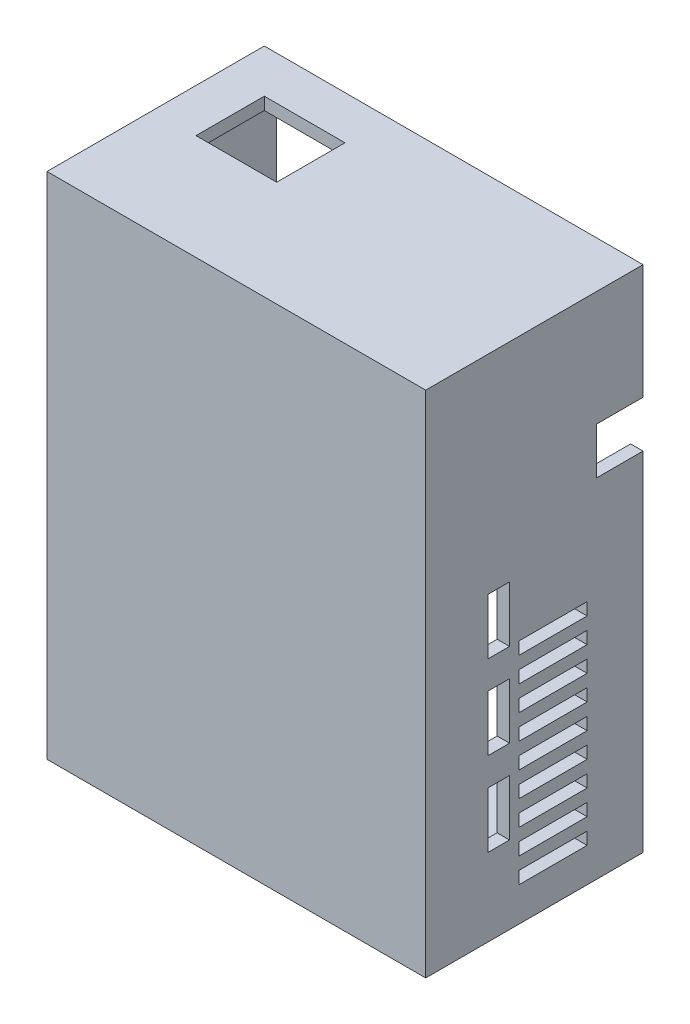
SolidWorks part; units mm, degrees
ref_plane "Alzado" through (0, 0, 0) normal (0, 0, 1) x (1, 0, 0)
ref_plane "Planta" through (0, 0, 0) normal (0, 1, 0) x (1, 0, 0)
ref_plane "Vista lateral" through (0, 0, 0) normal (1, 0, 0) x (0, 0, -1)
sketch "Croquis1" plane through (0, 0, 0) normal (0, 0, 1) x (1, 0, 0)
  line L1 (-64.8461, 56.6347) -> (-3.8461, 56.6347)
  line L2 (-64.8461, 56.6347) -> (-64.8461, -25.3653)
  line L3 (-64.8461, -25.3653) -> (-3.8461, -25.3653)
  line L4 (-3.8461, 56.6347) -> (-3.8461, -25.3653)
  line L5 (-64.8461, 56.6347) -> (-3.8461, -25.3653) construction
  line L6 (-64.8461, -25.3653) -> (-3.8461, 56.6347) construction
  point P0 (-34.3461, 15.6347)
  dimension "D1" = 82
  dimension "D2" = 61
extrude "Saliente-Extruir1" add sketch "Croquis1" along normal blind 35
sketch "Croquis2" plane through (0, 0, 0) normal (0, 0, -1) x (-1, 0, 0)
  line L0 (3.8461, -25.3653) -> (3.8461, 56.6347) construction
  line L1 (5.8461, 54.6347) -> (62.8461, 54.6347)
  line L2 (5.8461, 54.6347) -> (5.8461, -23.3653)
  line L3 (5.8461, -23.3653) -> (62.8461, -23.3653)
  line L4 (62.8461, 54.6347) -> (62.8461, -23.3653)
  line L5 (5.8461, 54.6347) -> (62.8461, -23.3653) construction
  line L6 (5.8461, -23.3653) -> (62.8461, 54.6347) construction
  line L7 (3.8461, 56.6347) -> (64.8461, 56.6347) construction
  point P0 (34.3461, 15.6347)
  dimension "D1" = 78
  dimension "D2" = 57
  dimension "D3" = 2
  dimension "D4" = 2
extrude "Cortar-Extruir1" cut sketch "Croquis2" against normal blind 33
sketch "Croquis3" plane through (0, 0, 0) normal (0, 0, -1) x (-1, 0, 0)
  line L0 (3.8461, 56.6347) -> (64.8461, 56.6347) construction
  line L1 (64.8461, 56.6347) -> (60.8461, 56.6347)
  line L2 (64.8461, 56.6347) -> (64.8461, 52.6347)
  line L3 (64.8461, 52.6347) -> (60.8461, 52.6347)
  line L4 (60.8461, 56.6347) -> (60.8461, 52.6347)
  line L5 (64.8461, 56.6347) -> (60.8461, 52.6347) construction
  line L6 (64.8461, 52.6347) -> (60.8461, 56.6347) construction
  line L7 (64.8461, 56.6347) -> (64.8461, -25.3653) construction
  line L8 (3.8461, -25.3653) -> (3.8461, 56.6347) construction
  line L9 (3.8461, 52.6347) -> (7.8461, 52.6347)
  line L10 (3.8461, 52.6347) -> (3.8461, 56.6347)
  line L11 (3.8461, 56.6347) -> (7.8461, 56.6347)
  line L12 (7.8461, 52.6347) -> (7.8461, 56.6347)
  line L13 (3.8461, 52.6347) -> (7.8461, 56.6347) construction
  line L14 (3.8461, 56.6347) -> (7.8461, 52.6347) construction
  line L15 (64.8461, -25.3653) -> (3.8461, -25.3653) construction
  line L16 (3.8461, -25.3653) -> (7.8461, -25.3653)
  line L17 (3.8461, -25.3653) -> (3.8461, -21.3653)
  line L18 (3.8461, -21.3653) -> (7.8461, -21.3653)
  line L19 (7.8461, -25.3653) -> (7.8461, -21.3653)
  line L20 (3.8461, -25.3653) -> (7.8461, -21.3653) construction
  line L21 (3.8461, -21.3653) -> (7.8461, -25.3653) construction
  line L22 (64.8461, -25.3653) -> (60.8461, -25.3653)
  line L23 (64.8461, -25.3653) -> (64.8461, -21.3653)
  line L24 (64.8461, -21.3653) -> (60.8461, -21.3653)
  line L25 (60.8461, -25.3653) -> (60.8461, -21.3653)
  line L26 (64.8461, -25.3653) -> (60.8461, -21.3653) construction
  line L27 (64.8461, -21.3653) -> (60.8461, -25.3653) construction
  point P0 (62.8461, 54.6347)
  point P9 (5.8461, 54.6347)
  point P16 (5.8461, -23.3653)
  point P21 (62.8461, -23.3653)
  dimension "D1" = 4
  dimension "D2" = 4
  dimension "D3" = 0
  dimension "D4" = 0
  dimension "D5" = 4
  dimension "D6" = 4
  dimension "D7" = 0
  dimension "D8" = 0
  dimension "D9" = 4
  dimension "D10" = 4
  dimension "D11" = 0
  dimension "D12" = 0
  dimension "D13" = 4
  dimension "D14" = 4
  dimension "D15" = 0
  dimension "D16" = 0
extrude "Saliente-Extruir2" add sketch "Croquis3" against normal blind 10
sketch "Croquis4" plane through (0, 0, 33) normal (0, 0, -1) x (-1, 0, 0)
  line L0 (56.8461, -5.3653) -> (56.8461, 44.6347) construction
  line L1 (62.8461, -23.3653) -> (62.8461, 54.6347) construction
  line L2 (5.8461, 54.6347) -> (62.8461, 54.6347) construction
  line L3 (9.3461, 42.1347) -> (59.3461, 42.1347) construction
  line L4 (5.8461, 54.6347) -> (5.8461, -23.3653) construction
  line L5 (59.3461, -5.3653) -> (9.3461, -5.3653) construction
  line L6 (59.3461, -5.3653) -> (59.3461, 44.6347) construction
  line L7 (59.3461, 44.6347) -> (9.3461, 44.6347) construction
  line L8 (9.3461, -5.3653) -> (9.3461, 44.6347) construction
  line L9 (11.8461, -5.3653) -> (11.8461, 44.6347) construction
  line L10 (59.3461, -2.8653) -> (9.3461, -2.8653) construction
  circle A0 centre (56.8461, -2.3653) radius 1.5
  circle A1 centre (11.8461, -2.8653) radius 1.5
  circle A2 centre (56.8461, 42.1347) radius 1.5
  circle A3 centre (11.8461, 42.1347) radius 1.5
  point P21 (56.8461, -2.3653)
  point P22 (11.8461, -2.8653)
  point P23 (11.8461, 42.1347)
  point P24 (56.8461, 42.1347)
  dimension "D1" = 50
  dimension "D2" = 50
  dimension "D3" = 3.5
  dimension "D4" = 50
  dimension "D5" = 3.5
  dimension "D6" = 10
  dimension "D7" = 2.5
  dimension "D8" = 2.5
  dimension "D9" = 2.5
  dimension "D10" = 2.5
extrude "Cortar-Extruir2" cut sketch "Croquis4" against normal blind 1.5
sketch "Croquis5" plane through (0, 0, 33) normal (0, 0, -1) x (-1, 0, 0)
  line L0 (5.8461, 51.1347) -> (61.6498, 51.1347) construction
  line L2 (62.8461, 54.6347) -> (5.8461, 54.6347) construction
  line L3 (62.8461, 33.1347) -> (-9.2086, 33.1347) construction
  line L4 (11.8461, 32.1347) -> (15.8461, 32.1347)
  line L5 (62.8461, 30.1347) -> (5.8461, 30.1347) construction
  line L6 (62.8461, -23.3653) -> (62.8461, 54.6347) construction
  line L7 (5.8461, 54.6347) -> (5.8461, -23.3653) construction
  line L8 (5.8461, 33.1347) -> (62.8461, 51.1347) construction
  line L9 (59.3461, 30.1347) -> (9.3461, 30.1347) construction
  line L10 (59.3461, 30.1347) -> (59.3461, -19.8653) construction
  line L11 (59.3461, -19.8653) -> (9.3461, -19.8653) construction
  line L12 (9.3461, 30.1347) -> (9.3461, -19.8653) construction
  line L13 (56.8461, -17.3653) -> (11.8461, -17.3653) construction
  line L14 (56.8461, -17.3653) -> (56.8461, 27.6347) construction
  line L15 (56.8461, 27.6347) -> (11.8461, 27.6347) construction
  line L16 (11.8461, -17.3653) -> (11.8461, 27.6347) construction
  line L17 (59.3461, -19.8653) -> (54.3461, -19.8653)
  line L18 (59.3461, -19.8653) -> (59.3461, -14.8653)
  line L19 (59.3461, -14.8653) -> (54.3461, -14.8653)
  line L20 (54.3461, -19.8653) -> (54.3461, -14.8653)
  line L21 (59.3461, -19.8653) -> (54.3461, -14.8653) construction
  line L22 (59.3461, -14.8653) -> (54.3461, -19.8653) construction
  line L23 (9.3461, -19.8653) -> (14.3461, -19.8653)
  line L24 (9.3461, -19.8653) -> (9.3461, -14.8653)
  line L25 (9.3461, -14.8653) -> (14.3461, -14.8653)
  line L26 (14.3461, -19.8653) -> (14.3461, -14.8653)
  line L27 (9.3461, -19.8653) -> (14.3461, -14.8653) construction
  line L28 (9.3461, -14.8653) -> (14.3461, -19.8653) construction
  line L29 (9.3461, 30.1347) -> (14.3461, 30.1347)
  line L30 (9.3461, 30.1347) -> (9.3461, 25.1347)
  line L31 (9.3461, 25.1347) -> (14.3461, 25.1347)
  line L32 (14.3461, 30.1347) -> (14.3461, 25.1347)
  line L33 (9.3461, 30.1347) -> (14.3461, 25.1347) construction
  line L34 (9.3461, 25.1347) -> (14.3461, 30.1347) construction
  line L35 (59.3461, 30.1347) -> (54.3461, 30.1347)
  line L36 (59.3461, 30.1347) -> (59.3461, 25.1347)
  line L37 (59.3461, 25.1347) -> (54.3461, 25.1347)
  line L38 (54.3461, 30.1347) -> (54.3461, 25.1347)
  line L39 (59.3461, 30.1347) -> (54.3461, 25.1347) construction
  line L40 (59.3461, 25.1347) -> (54.3461, 30.1347) construction
  line L41 (62.8461, 51.1347) -> (62.8461, 33.1347) construction
  line L42 (62.8461, 33.1347) -> (5.8461, 51.1347) construction
  line L43 (34.3461, 42.1347) -> (34.3461, 33.1347) construction
  line L44 (34.3461, 33.1347) -> (34.3461, 51.1347) construction
  line L45 (12.8461, 33.1347) -> (12.8461, 51.1347) construction
  line L46 (55.8461, 51.1347) -> (55.8461, 33.1347) construction
  line L47 (11.8461, 32.1347) -> (11.8461, 36.1347)
  line L48 (11.8461, 36.1347) -> (15.8461, 36.1347)
  line L49 (15.8461, 32.1347) -> (15.8461, 36.1347)
  line L50 (11.8461, 48.1347) -> (15.8461, 48.1347)
  line L51 (11.8461, 48.1347) -> (11.8461, 52.1347)
  line L52 (11.8461, 52.1347) -> (15.8461, 52.1347)
  line L53 (15.8461, 48.1347) -> (15.8461, 52.1347)
  line L54 (52.8461, 48.1347) -> (56.8461, 48.1347)
  line L55 (52.8461, 48.1347) -> (52.8461, 52.1347)
  line L56 (52.8461, 52.1347) -> (56.8461, 52.1347)
  line L57 (56.8461, 48.1347) -> (56.8461, 52.1347)
  line L58 (52.8461, 36.1347) -> (56.8461, 36.1347)
  line L59 (52.8461, 36.1347) -> (52.8461, 32.1347)
  line L60 (52.8461, 32.1347) -> (56.8461, 32.1347)
  line L61 (56.8461, 36.1347) -> (56.8461, 32.1347)
  line L62 (14.3461, 49.6347) -> (54.3461, 49.6347) construction
  line L63 (14.3461, 49.6347) -> (14.3461, 34.6347) construction
  line L64 (14.3461, 34.6347) -> (54.3461, 34.6347) construction
  line L65 (54.3461, 49.6347) -> (54.3461, 34.6347) construction
  circle A0 centre (56.8461, -17.3653) radius 1
  circle A1 centre (11.8461, -17.3653) radius 1
  circle A2 centre (56.8461, 27.6347) radius 1
  circle A3 centre (11.8461, 27.6347) radius 1
  circle A4 centre (54.3461, 49.6347) radius 0.6
  circle A5 centre (54.3461, 34.6347) radius 0.6
  circle A6 centre (14.3461, 49.6347) radius 0.6
  circle A7 centre (14.3461, 34.6347) radius 0.6
  point P40 (34.3461, 42.1347)
  point P64 (14.3461, 34.6347)
  point P65 (14.3461, 49.6347)
  dimension "D41" = 2
  dimension "D42" = 2
  dimension "D43" = 2
  dimension "D44" = 2
  dimension "D50" = 1.2
  dimension "D51" = 1.2
  dimension "D52" = 1.2
  dimension "D53" = 1.2
  dimension "D1" = 3.5
  dimension "D2" = 18
  dimension "D3" = 3
  dimension "D4" = 50
  dimension "D5" = 50
  dimension "D6" = 3.5
  dimension "D7" = 3.5
  dimension "D8" = 2.5
  dimension "D9" = 2.5
  dimension "D10" = 2.5
  dimension "D11" = 2.5
  dimension "D12" = 5
  dimension "D13" = 5
  dimension "D14" = 5
  dimension "D15" = 5
  dimension "D16" = 5
  dimension "D17" = 5
  dimension "D18" = 5
  dimension "D19" = 5
  dimension "D20" = 21.5
  dimension "D21" = 21.5
  dimension "D22" = 1
  dimension "D23" = 1
  dimension "D24" = 4
  dimension "D25" = 4
  dimension "D26" = 1
  dimension "D27" = 1
  dimension "D28" = 4
  dimension "D29" = 4
  dimension "D30" = 1
  dimension "D31" = 1
  dimension "D32" = 4
  dimension "D33" = 4
  dimension "D34" = 1
  dimension "D35" = 1
  dimension "D36" = 4
  dimension "D37" = 4
  dimension "D38" = 1.5
  dimension "D39" = 15
  dimension "D40" = 1.5
  dimension "D45" = 1.5
  dimension "D46" = 1.5
  dimension "D47" = 1.5
  dimension "D48" = 15
  dimension "D49" = 1.5
extrude "Saliente-Extruir3" add sketch "Croquis5" along normal blind 4
sketch "Croquis7" plane through (0, 0, 0) normal (0, 0, -1) x (-1, 0, 0)
  line L0 (7.8461, -21.3653) -> (3.8461, -25.3653) construction
  line L1 (3.8461, -25.3653) -> (7.8461, -25.3653) construction
  line L2 (64.8461, -25.3653) -> (3.8461, -25.3653) construction
  line L3 (7.8461, -25.3653) -> (7.8461, -21.3653) construction
  line L4 (7.8461, -21.3653) -> (3.8461, -21.3653) construction
  line L5 (3.8461, -25.3653) -> (3.8461, 56.6347) construction
  line L6 (3.8461, -21.3653) -> (7.8461, -25.3653) construction
  line L8 (7.8461, 52.6347) -> (5.3461, 52.6347) construction
  line L9 (5.8461, 52.6347) -> (7.8461, 52.6347) construction
  line L10 (5.3461, 52.6347) -> (5.3461, 55.1347) construction
  line L11 (5.3461, 55.1347) -> (7.8461, 55.1347) construction
  line L12 (7.8461, 52.6347) -> (7.8461, 54.6347) construction
  line L13 (7.8461, 55.1347) -> (5.3461, 52.6347) construction
  line L14 (5.3461, 52.6347) -> (7.8461, 52.6347) construction
  line L15 (7.8461, 52.6347) -> (5.3461, 55.1347) construction
  circle A0 centre (5.8461, -23.3653) radius 1
  point P10 (5.8461, -23.3653)
  dimension "D1" = 2
extrude "Cortar-Extruir3" cut sketch "Croquis7" against normal blind 6
sketch "Croquis9" plane through (0, 0, 33) normal (0, 0, -1) x (-1, 0, 0)
  line L0 (3.8461, -15.3653) -> (68.4902, -15.3653) construction
  line L1 (3.8461, -25.3653) -> (3.8461, 56.6347) construction
  line L2 (7.8461, -23.3653) -> (60.8461, -23.3653) construction
  line L3 (5.8461, 9.6347) -> (62.8461, 9.6347) construction
  line L4 (5.8461, 52.6347) -> (5.8461, -21.3653) construction
  line L5 (62.8461, -21.3653) -> (62.8461, 52.6347) construction
  line L6 (5.8461, 20.1347) -> (78.2307, 20.1347) construction
  line L7 (54.3461, 25.1347) -> (59.3461, 25.1347) construction
  dimension "D1" = 8
  dimension "D2" = 25
  dimension "D3" = 5
sketch "Croquis10" plane through (0, 0, 0) normal (0, 0, -1) x (-1, 0, 0)
  line L0 (64.8461, -25.3653) -> (60.8461, -21.3653) construction
  line L1 (60.8461, -21.3653) -> (64.8461, -21.3653) construction
  line L2 (64.8461, 56.6347) -> (64.8461, -25.3653) construction
  line L3 (64.8461, -21.3653) -> (60.8461, -25.3653) construction
  line L4 (64.8461, -25.3653) -> (3.8461, -25.3653) construction
  line L5 (60.8461, 52.6347) -> (64.8461, 56.6347) construction
  line L6 (64.8461, 56.6347) -> (64.8461, 52.6347) construction
  line L7 (64.8461, 52.6347) -> (60.8461, 56.6347) construction
  line L8 (3.8461, 56.6347) -> (64.8461, 56.6347) construction
  line L9 (7.8461, 52.6347) -> (3.8461, 56.6347) construction
  line L10 (3.8461, -25.3653) -> (3.8461, 56.6347) construction
  line L11 (3.8461, 56.6347) -> (7.8461, 56.6347) construction
  line L12 (7.8461, 56.6347) -> (3.8461, 52.6347) construction
  circle A0 centre (62.8461, -23.3653) radius 1
  circle A1 centre (5.8461, 54.6347) radius 1
  circle A2 centre (62.8461, 54.6347) radius 1
  point P7 (62.8461, -23.3653)
  point P17 (62.8461, 54.6347)
  point P29 (5.8461, 54.6347)
  dimension "D1" = 2
  dimension "D2" = 2
  dimension "D3" = 2
extrude "Cortar-Extruir4" cut sketch "Croquis10" against normal blind 6
sketch "Croquis11" plane through (-64.8461, 0, 0) normal (-1, 0, 0) x (0, 0, 1)
  line L0 (0, -15.3653) -> (34.0915, -15.3653) construction
  line L1 (0, 56.6347) -> (0, -25.3653) construction
  line L2 (35, -25.3653) -> (0, -25.3653) construction
  line L3 (0, 1.6347) -> (35, 1.6347) construction
  line L4 (35, 56.6347) -> (35, -25.3653) construction
  line L5 (0, 8.6347) -> (35, 8.6347) construction
  line L6 (7, 1.6347) -> (7, 8.6347) construction
  line L7 (7, 1.6347) -> (0, 1.6347)
  line L8 (0, 1.6347) -> (0, 8.6347)
  line L9 (0, 8.6347) -> (7, 8.6347)
  line L10 (7, 8.6347) -> (7, 1.6347)
  dimension "D1" = 10
  dimension "D2" = 17
  dimension "D3" = 7
  dimension "D4" = 7
extrude "Cortar-Extruir8" cut sketch "Croquis11" against normal blind 6
sketch "Croquis12" plane through (-3.8461, 0, 0) normal (1, 0, 0) x (0, 0, -1)
  line L0 (-7.5, 56.6347) -> (-7.5, -24.4809) construction
  line L1 (-35, 56.6347) -> (0, 56.6347) construction
  line L2 (-35, -25.3653) -> (-35, 56.6347) construction
  line L3 (-0.5, 56.6347) -> (-0.5, -25.3653) construction
  line L4 (-35, -25.3653) -> (0, -25.3653) construction
  dimension "D1" = 27.5
  dimension "D2" = 7
ref_plane "Plano1" through (-59.3461, 25.1347, 33) normal (-1, 0, 0) x (0, 0, 1)
ref_plane "Plano2" through (-14.3461, 25.1347, 33) normal (-1, 0, 0) x (0, 0, 1)
sketch "Croquis15" plane through (0, 0, 33) normal (0, 0, -1) x (-1, 0, 0)
  line L0 (9.3461, 25.1347) -> (14.3461, 25.1347) construction
sketch "Croquis16" plane through (-3.8461, 0, 0) normal (1, 0, 0) x (0, 0, -1)
  line L0 (-26.97, 20.1347) -> (0, 20.1347) construction
  line L1 (0, -25.3653) -> (0, 56.6347) construction
  line L2 (-35, 56.6347) -> (0, 56.6347) construction
  line L3 (0, 30.6347) -> (-16.7512, 30.6347) construction
  line L4 (0, 38.1347) -> (-17.6227, 38.1347) construction
  line L5 (0, 38.1347) -> (0, 30.6347)
  line L6 (0, 30.6347) -> (-7.4974, 30.6347)
  line L7 (-7.4974, 30.6347) -> (-7.4974, 38.1347)
  line L8 (-7.4974, 38.1347) -> (0, 38.1347)
  dimension "D1" = 36.5
  dimension "D2" = 10.5
  dimension "D3" = 7.5
extrude "Cortar-Extruir9" cut sketch "Croquis16" against normal blind 6
sketch "Croquis17" plane through (-64.8461, 0, 0) normal (-1, 0, 0) x (0, 0, 1)
  line L0 (33, -23.3653) -> (33, 54.6347) construction
  line L1 (33, 54.6347) -> (33, -23.3653) construction
  line L2 (33, -23.3653) -> (1.8861, -23.3653) construction
  line L3 (10, -23.3653) -> (0, -23.3653) construction
  line L4 (20, -23.3653) -> (20, 36.0783) construction
  line L5 (9, -23.3653) -> (9, 18.3473) construction
  line L7 (29, -19.8653) -> (6.385, -19.8653) construction
  line L8 (20, -13.8653) -> (9, -13.8653)
  line L9 (20, -19.8653) -> (9, -19.8653)
  line L10 (20, -19.8653) -> (20, -17.8653)
  line L11 (20, -17.8653) -> (9, -17.8653)
  line L12 (9, -19.8653) -> (9, -17.8653)
  line L13 (20, -15.8653) -> (9, -15.8653)
  line L14 (9, -15.8653) -> (9, -13.8653)
  line L15 (20, -15.8653) -> (20, -13.8653)
  line L16 (20, -9.8653) -> (9, -9.8653)
  line L17 (20, -11.8653) -> (9, -11.8653)
  line L18 (9, -11.8653) -> (9, -9.8653)
  line L19 (20, -11.8653) -> (20, -9.8653)
  line L20 (20, -5.8653) -> (9, -5.8653)
  line L21 (20, -7.8653) -> (9, -7.8653)
  line L22 (9, -7.8653) -> (9, -5.8653)
  line L23 (20, -7.8653) -> (20, -5.8653)
  line L24 (20, -1.8653) -> (9, -1.8653)
  line L25 (20, -3.8653) -> (9, -3.8653)
  line L26 (9, -3.8653) -> (9, -1.8653)
  line L27 (20, -3.8653) -> (20, -1.8653)
  line L28 (20, 2.1347) -> (9, 2.1347)
  line L29 (20, 0.1347) -> (9, 0.1347)
  line L30 (9, 0.1347) -> (9, 2.1347)
  line L31 (20, 0.1347) -> (20, 2.1347)
  line L32 (20, 6.1347) -> (9, 6.1347)
  line L33 (20, 4.1347) -> (9, 4.1347)
  line L34 (9, 4.1347) -> (9, 6.1347)
  line L35 (20, 4.1347) -> (20, 6.1347)
  line L36 (20, 10.1347) -> (9, 10.1347)
  line L37 (20, 8.1347) -> (9, 8.1347)
  line L38 (9, 8.1347) -> (9, 10.1347)
  line L39 (20, 8.1347) -> (20, 10.1347)
  line L40 (20, 14.1347) -> (9, 14.1347)
  line L41 (20, 12.1347) -> (9, 12.1347)
  line L42 (9, 12.1347) -> (9, 14.1347)
  line L43 (20, 12.1347) -> (20, 14.1347)
  line L44 (7, 1.6347) -> (7, 8.6347) construction
  point P17 (20, -19.8653)
  dimension "D1" = 2
  dimension "D2" = 11
  dimension "D4" = 2
  dimension "D5" = 9
extrude "Cortar-Extruir10" cut sketch "Croquis17" against normal blind 70
sketch "Croquis18" plane through (0, -25.3653, 0) normal (0, -1, 0) x (1, 0, 0)
  line L0 (-64.8461, 13) -> (-3.8461, 13) construction
  line L1 (-64.8461, 35) -> (-64.8461, 0) construction
  line L2 (-3.8461, 35) -> (-3.8461, 0) construction
  line L3 (-64.8461, 0) -> (-3.8461, 0) construction
  line L4 (-64.4984, 21) -> (3.5893, 21) construction
  line L5 (-64.8461, 35) -> (-3.8461, 35) construction
  line L6 (-64.8461, 13) -> (-3.8461, 21) construction
  line L7 (-3.8461, 21) -> (-3.8461, 13) construction
  line L8 (-3.8461, 13) -> (-64.4984, 21) construction
  line L9 (-64.8461, 33) -> (-3.8461, 33) construction
  line L10 (-30.3461, 13) -> (-38.3461, 13)
  line L11 (-30.3461, 13) -> (-30.3461, 21)
  line L12 (-30.3461, 21) -> (-38.3461, 21)
  line L13 (-38.3461, 13) -> (-38.3461, 21)
  line L14 (-30.3461, 13) -> (-38.3461, 21) construction
  line L15 (-30.3461, 21) -> (-38.3461, 13) construction
  line L16 (-64.8461, 29) -> (-3.8461, 29) construction
  line L17 (-58.8461, 33) -> (-58.8461, 29) construction
  line L18 (-51.3461, 29) -> (-51.3461, 33) construction
  line L19 (-41.3461, 33) -> (-41.3461, 21) construction
  line L21 (-41.3461, 21) -> (-51.3461, 21)
  line L22 (-41.3461, 21) -> (-41.3461, 29)
  line L23 (-41.3461, 29) -> (-51.3461, 29)
  line L24 (-51.3461, 21) -> (-51.3461, 29)
  line L25 (-15.8461, 7) -> (-10.8461, 7)
  line L26 (-15.8461, 7) -> (-15.8461, 12)
  line L27 (-15.8461, 12) -> (-10.8461, 12)
  line L28 (-10.8461, 7) -> (-10.8461, 12)
  line L29 (-15.8461, 7) -> (-10.8461, 12) construction
  line L30 (-15.8461, 12) -> (-10.8461, 7) construction
  point P12 (-34.3461, 17)
  point P28 (-13.3461, 9.5)
  dimension "D1" = 13
  dimension "D2" = 8
  dimension "D3" = 14
  dimension "D4" = 8
  dimension "D5" = 2
  dimension "D6" = 4
  dimension "D7" = 6
  dimension "D8" = 7.5
  dimension "D9" = 10
  dimension "D10" = 5
  dimension "D11" = 8
  dimension "D12" = 5
  dimension "D13" = 7
  dimension "D14" = 7
extrude "Cortar-Extruir11" cut sketch "Croquis18" against normal blind 7
sketch "Croquis19" plane through (0, -25.3653, 0) normal (0, -1, 0) x (1, 0, 0)
sketch "Croquis20" plane through (0, 56.6347, 0) normal (0, 1, 0) x (-1, 0, 0)
  line L1 (57.8461, 7) -> (44.8461, 7)
  line L2 (57.8461, 7) -> (57.8461, 18)
  line L3 (57.8461, 18) -> (44.8461, 18)
  line L4 (44.8461, 7) -> (44.8461, 18)
  line L5 (57.8461, 7) -> (44.8461, 18) construction
  line L6 (57.8461, 18) -> (44.8461, 7) construction
  line L7 (3.8461, 35) -> (64.8461, 35) construction
  line L9 (64.8461, 35) -> (64.8461, 0) construction
  point P0 (51.3461, 12.5)
  dimension "D1" = 13
  dimension "D2" = 11
  dimension "D3" = 7
  dimension "D4" = 17
extrude "Cortar-Extruir12" cut sketch "Croquis20" against normal blind 10
sketch "Croquis21" plane through (-3.8461, 0, 0) normal (1, 0, 0) x (0, 0, -1)
  line L0 (-25, -25.3653) -> (-25, -13.6084) construction
  line L2 (-35, -25.3653) -> (-35, 56.6347) construction
  line L3 (-35, -19.8653) -> (-9.7642, -19.8653) construction
  line L4 (-35, -25.3653) -> (0, -25.3653) construction
  line L5 (-21.5, -25.3653) -> (-21.5, -15.1837) construction
  line L6 (-25, -12.8653) -> (-21.5, -12.8653) construction
  line L7 (-25, -3.8653) -> (-21.5, -3.8653) construction
  line L9 (-21.5, -12.8653) -> (-25, -12.8653)
  line L10 (-21.5, -12.8653) -> (-21.5, -3.8653)
  line L11 (-21.5, -3.8653) -> (-25, -3.8653)
  line L12 (-25, -12.8653) -> (-25, -3.8653)
  line L13 (-25, 0.6347) -> (-21.5, 0.6347)
  line L14 (-25, 0.6347) -> (-25, 9.6347)
  line L15 (-25, 9.6347) -> (-21.5, 9.6347)
  line L16 (-21.5, 0.6347) -> (-21.5, 9.6347)
  line L17 (-25, 14.1347) -> (-21.5, 14.1347)
  line L18 (-25, 14.1347) -> (-25, 23.1347)
  line L19 (-25, 23.1347) -> (-21.5, 23.1347)
  line L20 (-21.5, 14.1347) -> (-21.5, 23.1347)
  dimension "D1" = 10
  dimension "D2" = 5.5
  dimension "D3" = 3.5
  dimension "D4" = 7
  dimension "D5" = 9
  dimension "D6" = 20.5
  dimension "D7" = 9
  dimension "D8" = 34
  dimension "D9" = 9
extrude "Cortar-Extruir13" cut sketch "Croquis21" against normal blind 2
